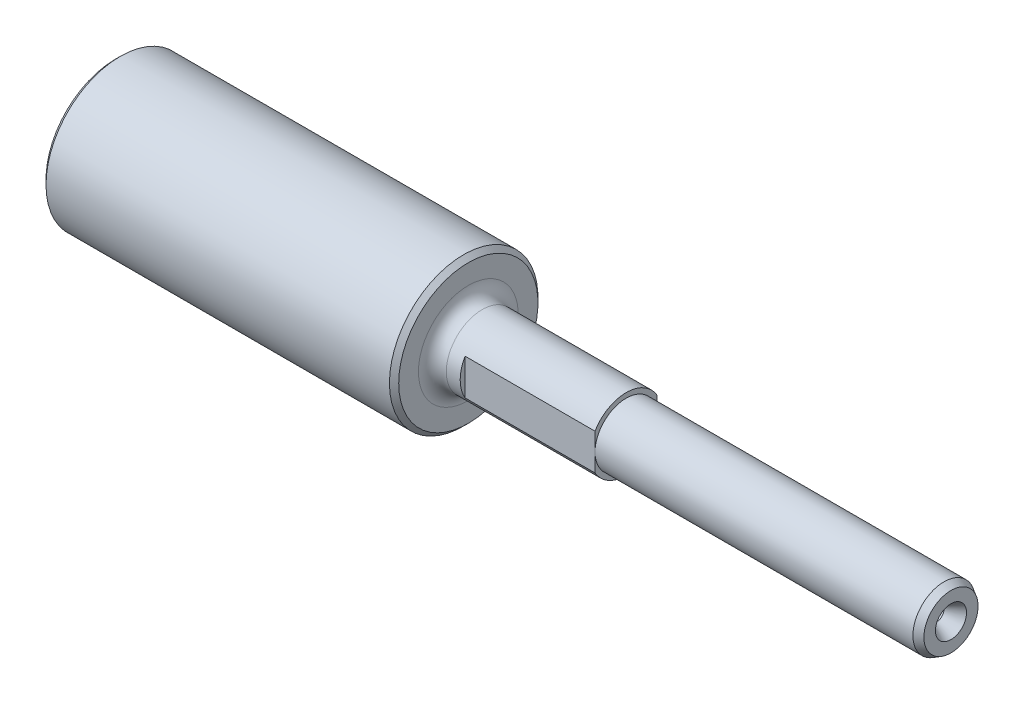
SolidWorks part; units mm, degrees
ref_plane "Plan de face" through (0, 0, 0) normal (0, 0, 1) x (1, 0, 0)
ref_plane "Plan de dessus" through (0, 0, 0) normal (0, 1, 0) x (1, 0, 0)
ref_plane "Plan de droite" through (0, 0, 0) normal (1, 0, 0) x (0, 0, -1)
sketch "Esquisse1" plane through (0, 0, 0) normal (0, 0, 1) x (1, 0, 0)
  line L0 (0, 0) -> (85.1663, 0) construction
  line L1 (0, 6.7) -> (0, 7.75)
  line L2 (70, 0) -> (-110, 0)
  line L4 (0, 6.7) -> (70, 6.7)
  line L5 (70, 0) -> (70, 6.7)
  line L6 (0, 7.75) -> (-34, 7.75)
  line L7 (-34, 7.75) -> (-34, 16)
  line L8 (-34, 16) -> (-110, 16)
  line L9 (-110, 16) -> (-110, 0)
  dimension "D1" = 13.4
  dimension "D2" = 70
  dimension "D3" = 32
  dimension "D4" = 180
  dimension "D5" = 76
  dimension "D6" = 15.5
revolve "Révolution1" add sketch "Esquisse1" angle 360 about L0
chamfer "Chanfrein1" distance 1.5 angle 30 1 edges at (70, 0, 6.7)
fillet "Congé1" radius 3 1 edges at (-34, 0, 7.75)
chamfer "Chanfrein2" distance 1 angle 45 2 edges at (-34, 0, 16) (-110, 0, 16)
sketch "Esquisse2" plane through (0, 0, 0) normal (1, 0, 0) x (0, 0, -1)
  line L0 (-6.7, 3.8952) -> (-6.7, -3.8952)
  line L1 (6.7, 3.8952) -> (6.7, -3.8952)
  circle A0 centre (0, 0) radius 7.75 construction
  arc A1 (-6.7, 3.8952) -> (-6.7, -3.8952) centre (0, 0) ccw
  circle A2 centre (0, 0) radius 6.7 construction
  circle A3 centre (0, 0) radius 6.7 construction
  arc A4 (6.7, -3.8952) -> (6.7, 3.8952) centre (0, 0) ccw
extrude "Enlèv. mat.-Extru.1" cut sketch "Esquisse2" against normal blind 28
hole_wizard "Fraisage pour vis à tête fraisée à 6 pans creux M101" positions "Esquisse4" profile "Esquisse3" countersink size "M10" standard "ISO"
sketch "Esquisse4" plane through (70, 0, 0) normal (1, 0, 0) x (0, 0, -1)
  point P0 (0, 0)
sketch "Esquisse3" plane through (70, 0, 0) normal (0, 1, 0) x (0, 0, -1)
  line L0 (0, 0) -> (0, 7.9464)
  line L1 (0, 7.9464) -> (1.575, 7)
  line L2 (1.575, 7) -> (1.575, 3.0744)
  line L3 (1.575, 3.0744) -> (3.35, 0)
  line L5 (3.35, 0) -> (0, 0)
  line L6 (-1.575, 3.0744) -> (-3.35, 0) construction
  line L10 (0, 7.9464) -> (-1.575, 7) construction
  line L11 (0, -6.35) -> (0, 107.95) construction
  dimension "Diamètre du perçage" = 3.15
  dimension "Profondeur du perçage" = 7
  dimension "Diamètre du fraisage entrant" = 6.7
  dimension "Angle du fraisage entrant" = 60
  dimension "Angle de pointe" = 118
